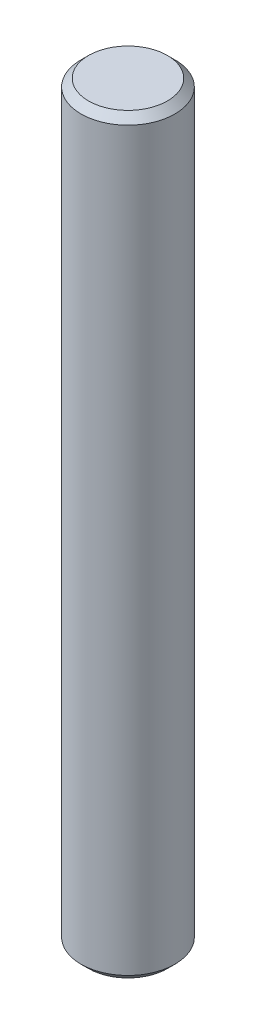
SolidWorks part; units mm, degrees
ref_plane "Front Plane" through (0, 0, 0) normal (0, 0, 1) x (1, 0, 0)
ref_plane "Top Plane" through (0, 0, 0) normal (0, 1, 0) x (1, 0, 0)
ref_plane "Right Plane" through (0, 0, 0) normal (1, 0, 0) x (0, 0, -1)
sketch "Sketch1" plane through (0, 0, 0) normal (0, 1, 0) x (1, 0, 0)
  circle A0 centre (0, 0) radius 12.5
  dimension "D1" = 25
extrude "Boss-Extrude1" add sketch "Sketch1" along normal blind 200
chamfer "Chamfer1" distance 2 angle 45 2 edges at (0, 0, 12.5) (0, 200, 12.5)
